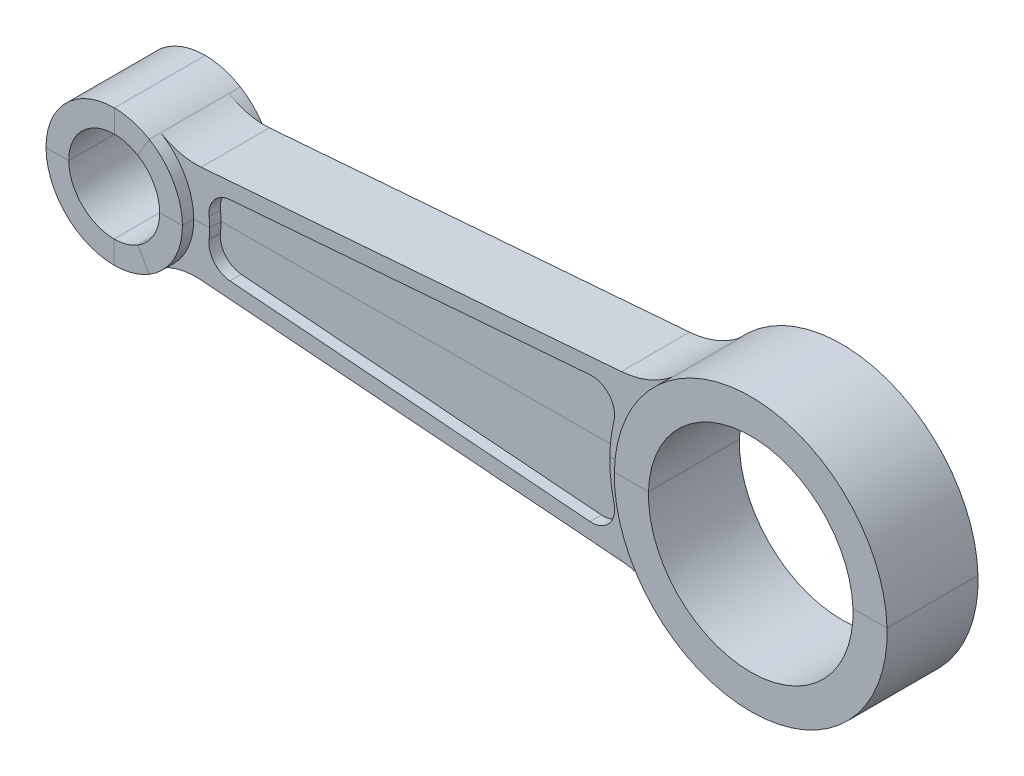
SolidWorks part; units mm, degrees
ref_plane "Front Plane" through (0, 0, 0) normal (0, 0, 1) x (1, 0, 0)
ref_plane "Top Plane" through (0, 0, 0) normal (0, 1, 0) x (1, 0, 0)
ref_plane "Right Plane" through (0, 0, 0) normal (1, 0, 0) x (0, 0, -1)
sketch "Sketch1" plane through (0, 0, 0) normal (0, 1, 0) x (1, 0, 0)
  line L0 (38.1, 25.4) -> (0, 25.4)
  line L1 (0, 25.4) -> (0, 19.05)
  line L2 (0, 19.05) -> (38.1, 19.05)
  line L3 (38.1, 19.05) -> (38.1, 25.4)
  line L4 (0, 25.4) -> (0, 19.05) construction
revolve "Revolve1" add sketch "Sketch1" angle 360 about L4
sketch "Sketch2" plane through (0, 0, -19.05) normal (0, 0, 1) x (1, 0, 0)
  line L0 (295.8347, -47.271) -> (42.2666, -27.3147)
  line L1 (42.2666, 27.3147) -> (295.8347, 47.271)
  arc A0 (295.8347, 47.271) -> (295.8347, -47.271) centre (355.6, 0) cw
  arc A1 (42.2666, -27.3147) -> (19.6386, -32.6486) centre (39.2773, -65.2973) ccw
  arc A2 (19.6386, -32.6486) -> (19.6386, 32.6486) centre (0, 0) cw
  arc A3 (19.6386, 32.6486) -> (42.2666, 27.3147) centre (39.2773, 65.2973) ccw
extrude "Boss-Extrude1" add sketch "Sketch2" along normal blind 44.45
sketch "Sketch3" plane through (0, 0, 25.4) normal (0, 0, 1) x (1, 0, 0)
  line L0 (42.2666, -27.3147) -> (295.8347, -47.271)
  line L1 (295.8347, 47.271) -> (42.2666, 27.3147)
  arc A0 (295.8347, -47.271) -> (295.8347, 47.271) centre (355.6, 0) cw
  arc A1 (42.2666, 27.3147) -> (19.6386, 32.6486) centre (39.2773, 65.2973) cw
  arc A2 (19.6386, 32.6486) -> (19.6386, -32.6486) centre (0, 0) cw
  arc A3 (19.6386, -32.6486) -> (42.2666, -27.3147) centre (39.2773, -65.2973) cw
extrude "Cut-Extrude1" cut sketch "Sketch3" against normal blind 6.35
sketch "Sketch4" plane through (0, 0, -19.05) normal (0, 0, -1) x (-1, 0, 0)
  circle A0 centre (-355.6, 0) radius 76.2
extrude "Boss-Extrude2" add sketch "Sketch4" along normal blind 6.35
sketch "Sketch5" plane through (0, 0, -19.05) normal (0, 0, -1) x (-1, 0, 0)
  line L0 (-43.2073, 18.4713) -> (-259.5169, 35.4952)
  line L1 (-259.5169, -35.4952) -> (-43.2073, -18.4713)
  arc A0 (-43.2073, -18.4713) -> (-43.2073, 18.4713) centre (0, 0) cw
  arc A1 (-259.5169, 35.4952) -> (-272.8622, 19.8689) centre (-260.5133, 22.8344) ccw
  arc A2 (-272.8622, 19.8689) -> (-272.8622, -19.8689) centre (-355.6, 0) cw
  arc A3 (-272.8622, -19.8689) -> (-259.5169, -35.4952) centre (-260.5133, -22.8344) ccw
extrude "Cut-Extrude2" cut sketch "Sketch5" against normal blind 6.35
sketch "Sketch6" plane through (0, 0, 19.05) normal (0, 0, 1) x (1, 0, 0)
  line L0 (259.5169, 35.4952) -> (43.2073, 18.4713)
  line L1 (43.2073, -18.4713) -> (259.5169, -35.4952)
  arc A0 (43.2073, 18.4713) -> (43.2073, -18.4713) centre (0, 0) cw
  arc A1 (259.5169, -35.4952) -> (272.8622, -19.8689) centre (260.5133, -22.8344) ccw
  arc A2 (272.8622, -19.8689) -> (272.8622, 19.8689) centre (355.6, 0) cw
  arc A3 (272.8622, 19.8689) -> (259.5169, 35.4952) centre (260.5133, 22.8344) ccw
extrude "Cut-Extrude3" cut sketch "Sketch6" against normal blind 6.35
hole_wizard "Hole1" positions "Sketch8" profile "Sketch7" legacy
sketch "Sketch8" plane through (0, 0, 25.4) normal (0, 0, 1) x (1, 0, 0)
  point P0 (355.6, 0)
sketch "Sketch7" plane through (355.6, 0, 25.4) normal (1, 0, 0) x (0, -1, 0)
  line L0 (0, 0) -> (0, 50.8)
  line L1 (0, 50.8) -> (57.15, 50.8)
  line L2 (57.15, 50.8) -> (57.15, 0)
  line L3 (57.15, 0) -> (0, 0)
  line L4 (0, 110) -> (0, -10) construction
  dimension "Diameter" = 114.3
  dimension "Depth" = 50.8
hole_wizard "Hole2" positions "Sketch10" profile "Sketch9" legacy
sketch "Sketch10" plane through (0, 0, 25.4) normal (0, 0, 1) x (1, 0, 0)
  point P0 (0, 0)
sketch "Sketch9" plane through (0, 0, 25.4) normal (1, 0, 0) x (0, -1, 0)
  line L0 (0, 0) -> (0, 50.8)
  line L1 (0, 50.8) -> (25.4, 50.8)
  line L2 (25.4, 50.8) -> (25.4, 0)
  line L3 (25.4, 0) -> (0, 0)
  line L4 (0, 110) -> (0, -10) construction
  dimension "Diameter" = 50.8
  dimension "Depth" = 50.8
fillet "Fillet1" radius 12.7 4 edges at (43.2073, 18.4713, 15.875) (43.2073, -18.4713, 15.875) (43.2073, 18.4713, -15.875) (43.2073, -18.4713, -15.875)
fillet "Fillet2" radius 50.8 2 edges at (295.8347, -47.271, 0) (295.8347, 47.271, 0)
sketch "Sketch11" plane through (0, 0, 25.4) normal (0, 0, 1) x (1, 0, 0)
  line L0 (0, 0) -> (0.2425, 70.8754)
  line L1 (0, 0) -> (-0.1925, -56.2477)
  point P0 (0, 0)
sketch "Sketch12" plane through (0, 0, 25.4) normal (0, 0, 1) x (1, 0, 0)
  line L0 (0, 0) -> (26.9831, 44.8586)
  line L1 (0, 0) -> (34.612, -57.5414)
  line L2 (0, 0) -> (0.15, 44.3977) construction
  line L3 (0, 0) -> (-0.203, -60.1108) construction
  arc A0 (42.2666, -27.3147) -> (19.6386, -32.6486) centre (39.2773, -65.2973) ccw construction
  arc A1 (19.6386, 32.6486) -> (42.2666, 27.3147) centre (39.2773, 65.2973) ccw construction
  arc A2 (42.2666, -27.3147) -> (19.6386, -32.6486) centre (39.2773, -65.2973) ccw construction
  arc A3 (19.6386, 32.6486) -> (42.2666, 27.3147) centre (39.2773, 65.2973) ccw construction
  point P0 (0, 0)
sketch "Sketch13" plane through (0, 0, 25.4) normal (0, 0, 1) x (1, 0, 0)
  line L0 (0, 0) -> (481.732, 2.5594)
  line L1 (0, 0) -> (-73.6004, -0.391)
  point P0 (0, 0)
